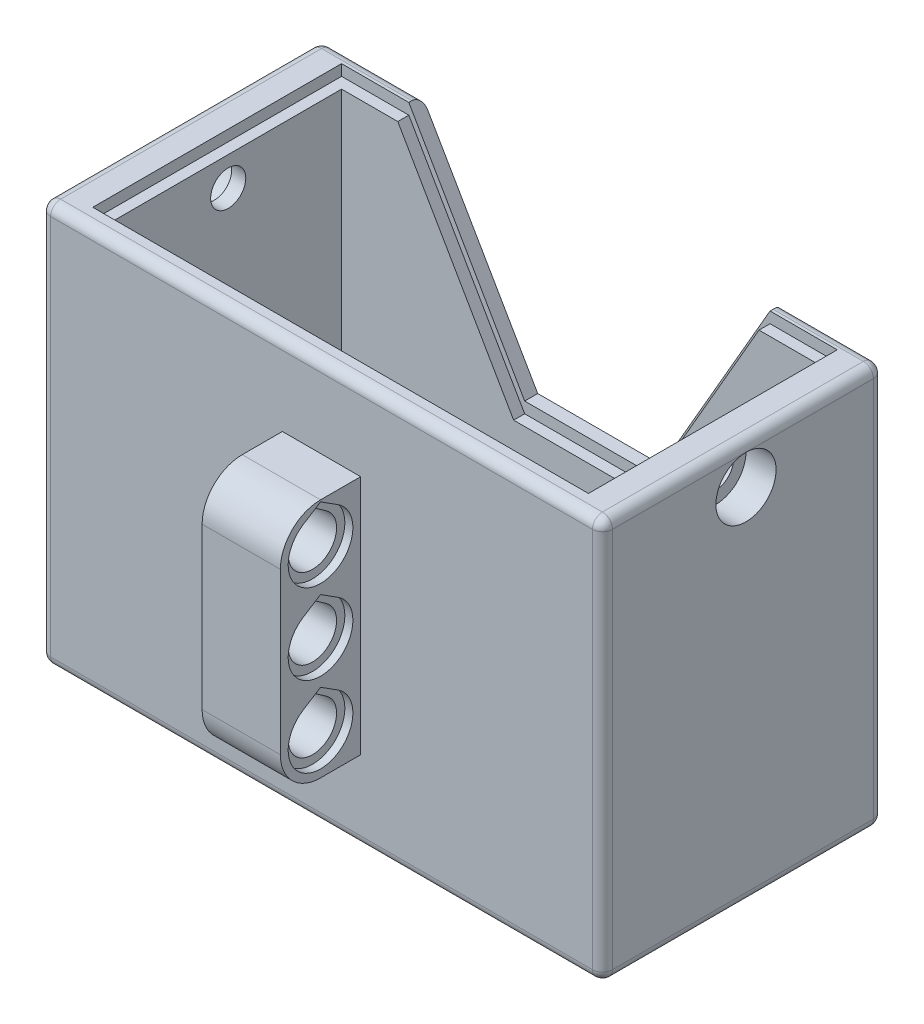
SolidWorks part; units mm, degrees
ref_plane "Ebene vorne" through (0, 0, 0) normal (0, 0, 1) x (1, 0, 0)
ref_plane "Ebene oben" through (0, 0, 0) normal (0, 1, 0) x (1, 0, 0)
ref_plane "Ebene rechts" through (0, 0, 0) normal (1, 0, 0) x (0, 0, -1)
sketch "Skizze1" plane through (0, 0, 0) normal (0, 1, 0) x (1, 0, 0)
  line L0 (0, 0) -> (0, 36.8308) construction
  line L1 (-28, 28) -> (-28, 0)
  line L2 (-28, 28) -> (28, 28)
  line L3 (-28, 0) -> (28, 0)
  line L4 (28, 28) -> (28, 0)
  line L5 (-28, 28) -> (28, 0) construction
  line L6 (-28, 0) -> (28, 28) construction
  line L7 (-28, 14) -> (28, 14) construction
  circle A0 centre (-13.05, 14) radius 8.5
  circle A1 centre (13.05, 14) radius 8.5
  point P3 (0, 0)
  point P4 (0, 14)
  dimension "D3" = 17
  dimension "D4" = 13.05
  dimension "D1" = 56
  dimension "D2" = 28
extrude "Front" add sketch "Skizze1" along normal blind 12
sketch "Skizze2" plane through (0, 12, 0) normal (0, 1, 0) x (1, 0, 0)
  line L1 (-28, 28) -> (28, 28)
  line L2 (-28, 28) -> (-28, 0)
  line L3 (-28, 0) -> (28, 0)
  line L4 (28, 28) -> (28, 0)
  line L5 (-23.6, 25.6) -> (23.6, 25.6)
  line L6 (-23.6, 25.6) -> (-23.6, 3)
  line L7 (-23.6, 3) -> (23.6, 3)
  line L8 (23.6, 25.6) -> (23.6, 3)
  dimension "D1" = 4.4
  dimension "D2" = 4.4
  dimension "D3" = 2.4
  dimension "D4" = 3
extrude "Walls" add sketch "Skizze2" along normal blind 28
sketch "Skizze3" plane through (0, 0, -28) normal (0, 0, -1) x (-1, 0, 0)
  line L0 (0, 40) -> (0, 0) construction
  line L1 (-28, 40) -> (28, 40) construction
  line L2 (-28, 0) -> (28, 0) construction
  line L3 (-18, 40) -> (-6.453, 20)
  line L4 (-6.453, 20) -> (6.453, 20)
  line L5 (-28, 40) -> (-28, 0) construction
  line L6 (-18, 40) -> (18, 40)
  line L7 (18, 40) -> (6.453, 20)
  point P13 (0, 20)
  dimension "D1" = 10
  dimension "D2" = 20
  dimension "D3" = 120
extrude "Ausschnittfür Montage" cut sketch "Skizze3" against normal up to surface (2.4 mm away)
sketch "Skizze4" plane through (0, 40, 0) normal (0, 1, 0) x (1, 0, 0)
  line L0 (-18, 25.6) -> (-23.6, 25.6)
  line L1 (-23.6, 25.6) -> (-23.6, 3)
  line L2 (-23.6, 3) -> (23.6, 3)
  line L3 (23.6, 3) -> (23.6, 25.6)
  line L4 (23.6, 25.6) -> (18, 25.6)
  line L5 (-18, 26.7) -> (-24.7, 26.7)
  line L6 (-24.7, 26.7) -> (-24.7, 1.9)
  line L7 (-24.7, 1.9) -> (24.7, 1.9)
  line L8 (24.7, 1.9) -> (24.7, 26.7)
  line L9 (24.7, 26.7) -> (18, 26.7)
  line L10 (-18, 26.7) -> (-18, 25.6)
  line L11 (18, 26.7) -> (18, 25.6)
  dimension "D1" = 1.1
extrude "Schnitt-Linear austragen2" cut sketch "Skizze4" against normal blind 1.1
sketch "Skizze5" plane through (0, 0, -25.6) normal (0, 0, 1) x (1, 0, 0)
  line L0 (-18, 38.9) -> (-18, 40)
  line L1 (-18, 40) -> (-6.453, 20)
  line L2 (-6.453, 20) -> (6.453, 20)
  line L3 (6.453, 20) -> (18, 40)
  line L4 (18, 40) -> (18, 38.9)
  line L5 (18, 38.9) -> (6.453, 18.9)
  line L6 (6.453, 18.9) -> (-6.453, 18.9)
  line L7 (-6.453, 18.9) -> (-18, 38.9)
  dimension "D1" = 1.1
extrude "Schnitt-Linear austragen3" cut sketch "Skizze5" against normal blind 1.1
sketch "Skizze6" plane through (0, 12, 0) normal (0, 1, 0) x (1, 0, 0)
  line L0 (0, 0) -> (0, 28) construction
  line L1 (-28, 0) -> (28, 0) construction
  line L2 (6.453, 28) -> (-6.453, 28) construction
  line L3 (-21.2, 22.6) -> (-21.2, 5) construction
  line L4 (-23.6, 3) -> (-23.6, 25.6) construction
  line L5 (-23.6, 25.6) -> (-18, 25.6) construction
  line L6 (23.6, 3) -> (-23.6, 3) construction
  line L7 (5, 18.6) -> (-5, 18.6)
  line L8 (-5, 18.6) -> (-9.9015, 25.6)
  line L9 (23.6, 25.6) -> (-23.6, 25.6) construction
  line L10 (-9.9015, 25.6) -> (9.9015, 25.6)
  line L11 (21.2, 22.6) -> (21.2, 5) construction
  line L12 (5, 18.6) -> (9.9015, 25.6)
  line L18 (5, 7) -> (5, 3)
  line L19 (5, 7) -> (-5, 7)
  line L20 (5, 3) -> (-5, 3)
  line L21 (-5, 7) -> (-5, 3)
  line L22 (5, 7) -> (-5, 3) construction
  line L23 (5, 3) -> (-5, 7) construction
  line L24 (-23.6, 3) -> (23.6, 3) construction
  circle A0 centre (-21.2, 22.6) radius 0.75
  circle A1 centre (-21.2, 5) radius 0.75
  circle A2 centre (21.2, 5) radius 0.75
  circle A3 centre (21.2, 22.6) radius 0.75
  point P27 (0, 25.6)
  point P28 (0, 18.6)
  point P29 (0, 5)
  dimension "D2" = 3
  dimension "D3" = 2
  dimension "D4" = 1.5
  dimension "D5" = 1.5
  dimension "D1" = 2.4
  dimension "D6" = 7
  dimension "D7" = 125
  dimension "D8" = 5
  dimension "D9" = 10
  dimension "D10" = 4
  dimension "D11" = 5
  dimension "D12" = 0
extrude "Ausschnitt_Montage_Sensor" cut sketch "Skizze6" against normal blind 6
sketch "Skizze7" plane through (0, 0, -3) normal (0, 0, -1) x (-1, 0, 0)
  line L0 (0, 0) -> (0, 40) construction
  line L1 (24.7, 40) -> (-24.7, 40) construction
  circle A0 centre (-6, 30.4) radius 1.75
  circle A1 centre (6, 30.4) radius 1.75
  dimension "D1" = 9.6
  dimension "D2" = 6
  dimension "D3" = 3.5
extrude "Aufsatz-Linear austragen3" add sketch "Skizze7" along normal blind 1
sketch "Skizze8" plane through (0, 0, -4) normal (0, 0, -1) x (-1, 0, 0)
  circle A0 centre (-6, 30.4) radius 0.9
  circle A1 centre (6, 30.4) radius 0.9
  dimension "D1" = 1.8
  dimension "D2" = 1.8
extrude "Schnitt-Linear austragen5" cut sketch "Skizze8" against normal offset from surface (3 mm away) 1
sketch "Skizze9" plane through (28, 0, 0) normal (1, 0, 0) x (0, 0, -1)
  line L0 (28, 40) -> (28, 0) construction
  line L1 (0, 40) -> (28, 40) construction
  circle A0 centre (14.3, 36) radius 1.75
  dimension "D1" = 3.5
  dimension "D2" = 13.7
  dimension "D3" = 4
extrude "Schnitt-Linear austragen6" cut sketch "Skizze9" against normal up to surface (51.6 mm away)
sketch "Skizze10" plane through (28, 0, 0) normal (1, 0, 0) x (0, 0, -1)
  circle A0 centre (14.3, 36) radius 3
  dimension "D1" = 6
extrude "Schnitt-Linear austragen7" cut sketch "Skizze10" against normal blind 3
mirror "Spiegeln1" about plane through (0, 0, 0) normal (1, 0, 0) of "Schnitt-Linear austragen6", "Schnitt-Linear austragen7"
fillet "Verrundung1" radius 1 13 edges at (0, 0, 0) (0, 0, -28) (28, 0, -14) (28, 20, 0) (28, 20, -28) (23, 40, -28) (28, 40, -14) (-28, 0, -14) (0, 40, 0) (-28, 20, 0) (-23, 40, -28) (-28, 40, -14) (-28, 20, -28)
fillet "Verrundung2" radius 2 2 edges at (13.05, 0, -22.5) (-13.05, 0, -5.5)
sketch "Skizze11" plane through (0, 0, 0) normal (1, 0, 0) x (0, 0, -1)
  line L0 (0, 32) -> (-4, 32)
  line L1 (0, 1) -> (0, 39) construction
  line L2 (-8, 28) -> (-8, 12)
  line L3 (-4, 8) -> (0, 8)
  line L4 (0, 8) -> (0, 32)
  line L5 (27, 0) -> (1, 0) construction
  line L6 (-4, 12) -> (-4, 24.0167) construction
  line L7 (-4, 14.9299) -> (-5.3766, 13.966)
  line L8 (-4, 14.9299) -> (-2.6234, 13.966)
  line L9 (-4, 22.9299) -> (-5.3766, 21.966)
  line L10 (-4, 22.9299) -> (-2.6234, 21.966)
  line L11 (-4, 30.9299) -> (-5.3766, 29.966)
  line L12 (-4, 30.9299) -> (-2.6234, 29.966)
  arc A0 (-5.3766, 13.966) -> (-2.6234, 13.966) centre (-4, 12) ccw
  arc A1 (-5.3766, 21.966) -> (-2.6234, 21.966) centre (-4, 20) ccw
  arc A2 (-5.3766, 29.966) -> (-2.6234, 29.966) centre (-4, 28) ccw
  arc A3 (-8, 12) -> (-4, 8) centre (-4, 12) ccw
  arc A4 (-4, 32) -> (-8, 28) centre (-4, 28) ccw
  point P23 (-8, 8)
  point P26 (-8, 32)
  dimension "D4" = 4.8
  dimension "D6" = 12
  dimension "D9" = 4
  dimension "D1" = 4
  dimension "D2" = 4
  dimension "D3" = 8
  dimension "D5" = 24
  dimension "D7" = 110
  dimension "D8" = 3
extrude "Aufsatz-Linear austragen4" add sketch "Skizze11" along normal blind 3.9
sketch "Skizze12" plane through (3.9, 0, 0) normal (1, 0, 0) x (0, 0, -1)
  line L0 (-4, 28) -> (-4, 39.3802) construction
  line L1 (-4, 31.8238) -> (-5.7328, 30.7199)
  line L2 (-4, 31.8238) -> (-2.2672, 30.7199)
  line L3 (-4, 23.8238) -> (-5.7328, 22.7199)
  line L4 (-4, 23.8238) -> (-2.2672, 22.7199)
  line L5 (-4, 15.8238) -> (-5.7328, 14.7199)
  line L6 (-4, 15.8238) -> (-2.2672, 14.7199)
  arc A0 (-5.7328, 30.7199) -> (-2.2672, 30.7199) centre (-4, 28) ccw
  arc A1 (-5.7328, 22.7199) -> (-2.2672, 22.7199) centre (-4, 20) ccw
  arc A2 (-5.7328, 14.7199) -> (-2.2672, 14.7199) centre (-4, 12) ccw
  dimension "D1" = 6.45
  dimension "D2" = 115
  dimension "D3" = 3
extrude "Schnitt-Linear austragen8" cut sketch "Skizze12" against normal blind 0.8
mirror "Spiegeln2" about plane through (0, 0, 0) normal (1, 0, 0) of "Aufsatz-Linear austragen4", "Schnitt-Linear austragen8"
